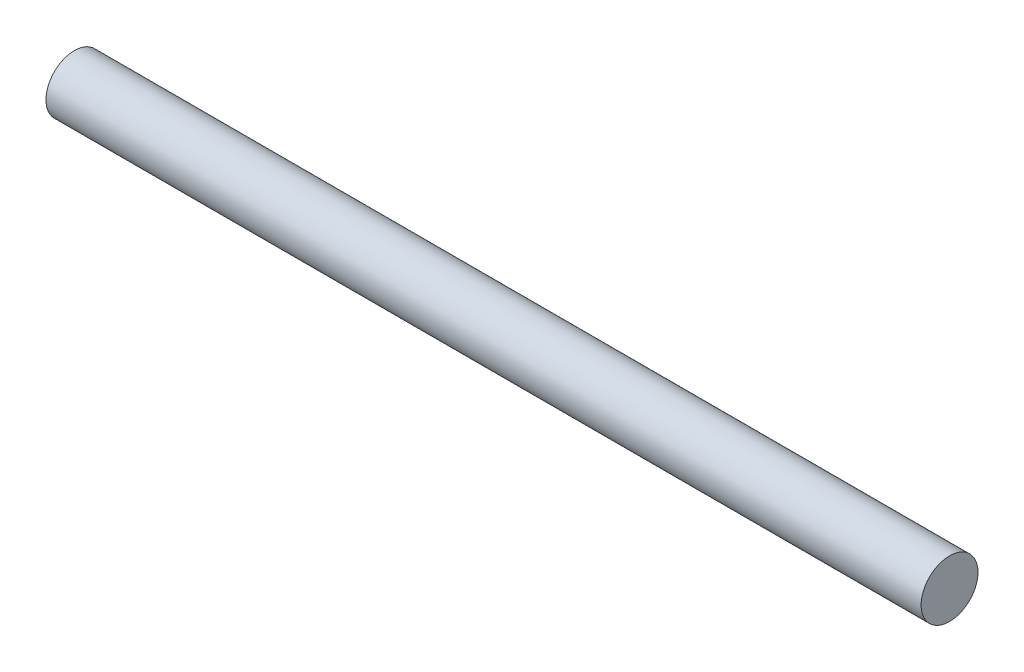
SolidWorks part; units mm, degrees
ref_plane "Front Plane" through (0, 0, 0) normal (0, 0, 1) x (1, 0, 0)
ref_plane "Top Plane" through (0, 0, 0) normal (0, 1, 0) x (1, 0, 0)
ref_plane "Right Plane" through (0, 0, 0) normal (1, 0, 0) x (0, 0, -1)
sketch "Sketch1" plane through (0, 0, 0) normal (1, 0, 0) x (0, 0, -1)
  circle A0 centre (0, 0) radius 1.651
extrude "Boss-Extrude1" add sketch "Sketch1" along normal blind 50.8
